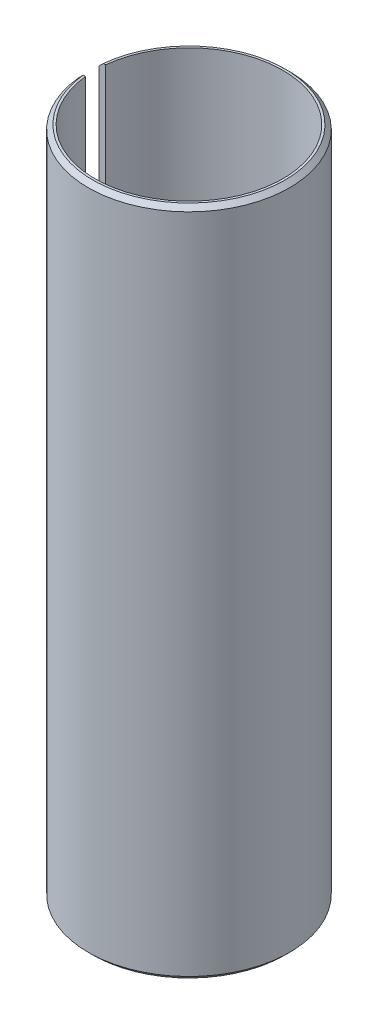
SolidWorks part; units mm, degrees
ref_plane "Face" through (0, 0, 0) normal (0, 0, 1) x (1, 0, 0)
ref_plane "Dessus" through (0, 0, 0) normal (0, 1, 0) x (1, 0, 0)
ref_plane "Droite" through (0, 0, 0) normal (1, 0, 0) x (0, 0, -1)
sketch "Esquisse1" plane through (0, 0, 0) normal (0, 0, 1) x (1, 0, 0)
  line L1 (2.8, 10) -> (2.8, -10)
  line L2 (-3, 0) -> (3, 0) construction
  line L3 (2.8, 10) -> (3, 10)
  line L4 (3, -10) -> (2.8, -10)
  line L5 (0, 10) -> (0, -10) construction
  line L6 (3, 10) -> (3, -10)
  dimension "Epaisseur" = 0.2
  dimension "Longueur" = 20
  dimension "Diamètre nominal" = 6
revolve "Base-Révolution" add sketch "Esquisse1" angle 360 about L5
chamfer "Chanfrein1" distance 0.1333 angle 45 2 edges at (0, -10, 3) (0, 10, 3)
sketch "Esquisse2" plane through (0, 0, 0) normal (0, 1, 0) x (-1, 0, 0)
  line L0 (0, 0) -> (3, 0) construction
  line L1 (0, 0.3) -> (0, -0.3)
  line L2 (0, -0.3) -> (3, -0.3)
  line L3 (3, 0.3) -> (3, -0.3)
  line L4 (0, 0.3) -> (3, 0.3)
  circle A0 centre (0, 0) radius 3 construction
  dimension "Frep" = 0.3
extrude "Enlèv. mat.-Extru.1" cut sketch "Esquisse2" against normal through all and the other way through all
equation "\"Ch@Chanfrein1\" = \"Epaisseur@Esquisse1\"/1.5"
equation "\"Frep@Esquisse2\" = (\"Diamètre nominal@Esquisse1\"/2)*0.1"
